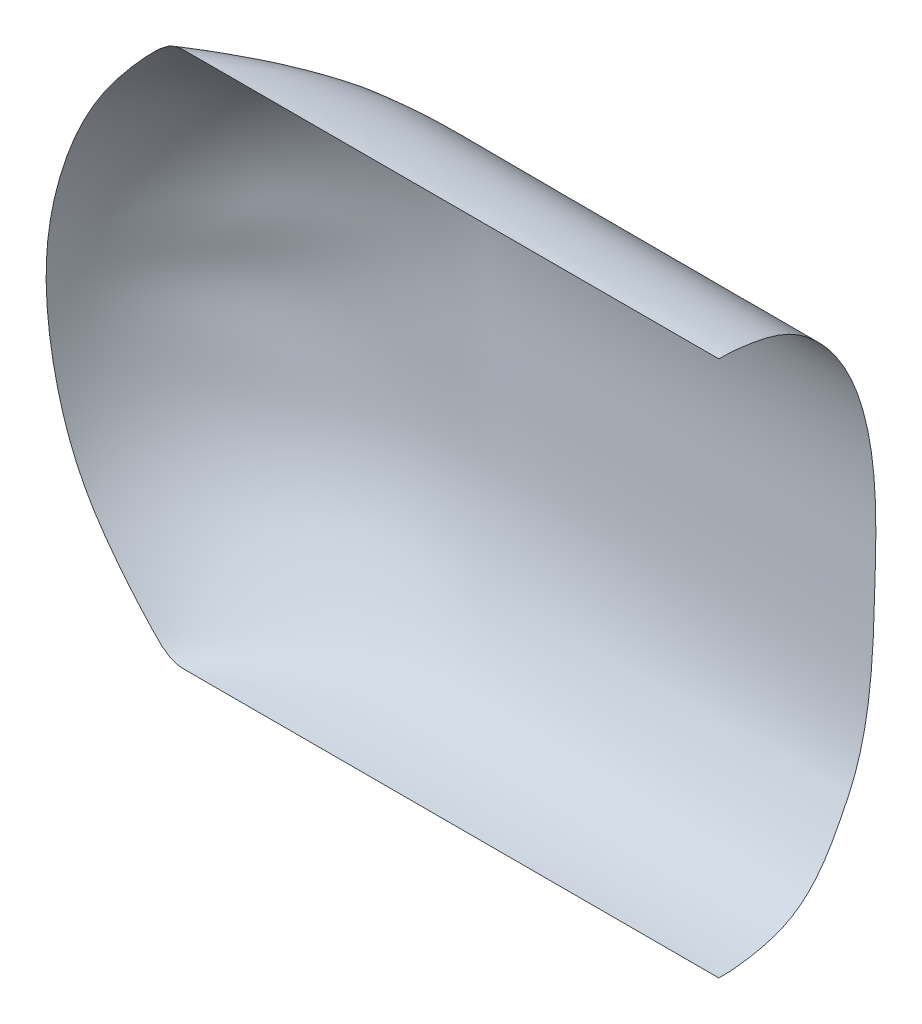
SolidWorks part; units mm, degrees
other "Detailelement1"
other "Detailelement2"
ref_plane "Vorne" through (0, 0, 0) normal (0, 0, 1) x (1, 0, 0)
ref_plane "Oben" through (0, 0, 0) normal (0, 1, 0) x (1, 0, 0)
ref_plane "Rechts" through (0, 0, 0) normal (1, 0, 0) x (0, 0, -1)
ref_plane "Ebene9" through (-2.6, 0, 0) normal (1, 0, 0) x (0, 0, -1)
sketch "Skizze1" plane through (0, 0, 0) normal (1, 0, 0) x (0, 0, -1)
  line L0 (3.2, 156.8) -> (0, 156.8) construction
  line L1 (0, 50) -> (0, -50) construction
  line L2 (3.2, 0.2) -> (0, 0.2) construction
  spline S0 degree 3 poles (3.2, 156.8) (15.2457, 155.9042) (27.1788, 150.7711) (41.6052, 131.374) (46.4817, 103.4678) (45.6711, 76.7617) (44.9684, 50.2216) (41.0626, 33.5474) (33.7229, 18.6011) (27.0223, 4.6845) (11.2445, 0.838) (3.2, 0.2) knots 0 0 0 0 0.105782 0.226264 0.395331 0.515131 0.648751 0.76968 0.76968 0.912711 1 1 1 1 construction
  spline S1 degree 3 poles (0, 156.8) (0.9827, 156.8) (1.9655, 156.8) (2.9482, 156.8) (3.0017, 156.8) (3.1086, 156.8) (3.2692, 156.7949) (3.3758, 156.7868) (3.4291, 156.7827) (3.4546, 156.7808) (3.5055, 156.7769) (3.5819, 156.7709) (3.6328, 156.7669) (3.6583, 156.7649) (15.388, 155.8427) (27.2281, 150.7048) (41.6052, 131.374) (46.4817, 103.4678) (45.6711, 76.7617) (44.9684, 50.2216) (41.0626, 33.5474) (33.7229, 18.6011) (27.0669, 4.7771) (11.4542, 0.8897) (3.6221, 0.2344) (3.5987, 0.2324) (3.5518, 0.2285) (3.4814, 0.2227) (3.4345, 0.2189) (3.411, 0.217) (3.3558, 0.2125) (3.2454, 0.2035) (3.0789, 0.2) (2.9681, 0.2) (2.9127, 0.2) (1.9418, 0.2) (0.9709, 0.2) (0, 0.2) knots 0 0 0 0 0.008542 0.008542 0.008542 0.009007 0.009472 0.009936 0.009936 0.009936 0.010158 0.01038 0.010602 0.010602 0.010602 0.112873 0.230863 0.396434 0.513757 0.644613 0.76304 0.76304 0.903113 0.987095 0.987095 0.987095 0.987347 0.987598 0.98785 0.98785 0.98785 0.988442 0.989033 0.989625 0.989625 0.989625 1 1 1 1
  dimension "D1" = 3.2
  dimension "D2" = 0.2
  dimension "D3" = 156.6
  dimension "D4" = 18.7
  dimension "D5" = 5
  dimension "D6" = 34.5
  dimension "D7" = 26.5
  dimension "D8" = 77
  dimension "D9" = 42.5
  dimension "D10" = 42.5
  dimension "D11" = 100.4
  dimension "D12" = 35.4
  dimension "D13" = 132.6
  dimension "D14" = 149.6
  dimension "D15" = 22.4
  dimension "D16" = 49.5
  dimension "D17" = 40.8
ref_plane "Ebene1" through (0, 5.2, 0) normal (0, 1, 0) x (-1, 0, 0)
ref_plane "Ebene2" through (0, 26.7, 0) normal (0, 1, 0) x (-1, 0, 0)
ref_plane "Ebene3" through (0, 49.7, 0) normal (0, 1, 0) x (-1, 0, 0)
ref_plane "Ebene4" through (0, 77.2, 0) normal (0, 1, 0) x (-1, 0, 0)
ref_plane "Ebene5" through (0, 100.6, 0) normal (0, 1, 0) x (-1, 0, 0)
ref_plane "Ebene6" through (0, 132.8, 0) normal (0, 1, 0) x (-1, 0, 0)
ref_plane "Ebene7" through (0, 149.8, 0) normal (0, 1, 0) x (-1, 0, 0)
ref_plane "Ebene8" through (0, 156.8, 0) normal (0, 1, 0) x (-1, 0, 0)
ref_plane "Ebene16" through (0, 156, 0) normal (0, 1, 0) x (-1, 0, 0)
sketch "Skizze49" plane through (0, 0, 0) normal (0, 0, 1) x (1, 0, 0)
  line L5 (-160.3768, -1.5) -> (-112.2, -1.5) construction
  line L12 (160.3768, 158.5) -> (-160.3768, 158.5)
  line L13 (-112.2, -1.5) -> (160.3768, -1.5)
  line L14 (-112.2, 97.5) -> (-112.2, -1.5)
  line L15 (-196.7324, 97.5) -> (-112.2, 97.5)
  arc A1 (-196.7324, 97.5) -> (-160.3768, -1.5) centre (-95.5, 78.5) ccw construction
  arc A4 (160.3768, -1.5) -> (160.3768, 158.5) centre (95.5, 78.5) ccw
  arc A5 (-160.3768, 158.5) -> (-196.7324, 97.5) centre (-95.5, 78.5) ccw
  point P0 (0, 158.5)
  point P1 (-198.5, 78.5)
  dimension "D1" = 103
  dimension "D2" = 95.5
  dimension "D3" = 160.3768
  dimension "D4" = 78.5
  dimension "D5" = 112.2
  dimension "D7" = 196.7324
sketch "Skizze2" plane through (0, 0, 0) normal (0, 0, 1) x (1, 0, 0)
  line L3 (0, 0) -> (0, 174.3868) construction
  line L9 (160.3768, 157) -> (-160.3768, 157)
  line L10 (0, 157) -> (-156.7291, 157) construction
  line L12 (-112.2, 0) -> (160.3768, 0)
  line L13 (-156.7291, 0) -> (0, 0) construction
  arc A2 (-156.7291, 157) -> (-162.3253, 154.8978) centre (-156.7291, 148.5) ccw
  arc A3 (-159.432, 157.335) -> (-195.2581, 97.2233) centre (-95.5, 78.5) ccw
  arc A4 (-162.3253, 154.8978) -> (-162.3253, 2.1022) centre (-95.5, 78.5) ccw
  arc A5 (-156.7291, 0) -> (-162.3253, 2.1022) centre (-156.7291, 8.5) cw
  dimension "D4" = 8.5
  dimension "D1" = 1.5
  dimension "D2" = 1.5
  dimension "D3" = 1.5
ref_plane "Ebene14" through (-131, 0, 0) normal (1, 0, 0) x (0, 0, -1)
sketch "Skizze55" plane through (0, 156, 0) normal (0, 1, 0) x (-1, 0, 0)
  line L0 (0, -14) -> (111.4939, -14)
  line L3 (156.7291, 0) -> (0, 0) construction
  line L4 (131, 31.1553) -> (131, -31.1553) construction
  spline S0 degree 3 poles (111.4939, -14) (115.4531, -14) (129.06, -13.3693) (148.1121, -12.3425) (157.9547, -2.7141) (160.7291, 0) knots 0 0 0 0 0.228126 0.782425 1 1 1 1
  point P7 (131, -13.1697)
  dimension "D1" = 14
sketch "Skizze50" plane through (-131, 0, 0) normal (1, 0, 0) x (0, 0, -1)
  line L0 (0, 0) -> (0, 174.3868) construction
  line L1 (0, 157) -> (0, 0) construction
  line L2 (0, 50) -> (0, -50) construction
  line L4 (50, 149.8) -> (-50, 149.8) construction
  line L5 (50, 132.8) -> (-50, 132.8) construction
  line L6 (50, 100.6) -> (-50, 100.6) construction
  line L7 (50, 77.2) -> (-50, 77.2) construction
  line L8 (50, 49.7) -> (-50, 49.7) construction
  line L9 (50, 26.7) -> (-50, 26.7) construction
  line L10 (50, 5.2) -> (-50, 5.2) construction
  spline S0 degree 3 poles (0, 157) (8.5122, 156.9557) (23.9183, 152.7103) (40.1662, 129.7413) (44.5725, 103.6919) (44.4936, 75.8497) (44.4405, 50.8612) (36.8503, 25.6232) (22.7946, 3.5725) (7.2538, 0.192) (0, 0) knots 0 0 0 0 0.122149 0.228137 0.392574 0.509781 0.647785 0.766119 0.899169 1 1 1 1
  dimension "D1" = 19.5
  dimension "D2" = 36
  dimension "D3" = 43
  dimension "D4" = 44.5
  dimension "D5" = 44
  dimension "D6" = 36.5
  dimension "D7" = 23.3
sketch "Skizze3" plane through (0, 77.2, 0) normal (0, 1, 0) x (-1, 0, 0)
  line L6 (0, -45.7) -> (109.9917, -45.7) construction
  line L7 (109.9917, -45.7) -> (0, -45.7)
  spline S0 degree 3 poles (196.9917, 0) (187.6717, -20.6245) (169.0841, -45.7) (109.9917, -45.7) knots 0 0 0 0 0.464629 0.464629 0.464629 0.464629
  dimension "D1" = 87
sketch "Skizze4" plane through (0, 100.6, 0) normal (0, 1, 0) x (-1, 0, 0)
  line L0 (109.9917, -45.7) -> (0, -45.7) construction
  line L2 (113.016, -45.7) -> (0, -45.7)
  spline S0 degree 3 poles (194.5648, 0) (191.7981, -9.8156) (178.628, -24.8693) (152.7983, -40.1344) (128.4869, -45.7) (113.016, -45.7) knots 0 0 0 0 0.262153 0.414728 1 1 1 1
sketch "Skizze5" plane through (0, 132.8, 0) normal (0, 1, 0) x (-1, 0, 0)
  line L0 (111.8072, -38.6) -> (0, -38.6)
  spline S0 degree 3 poles (181.2541, 0) (178.0784, -7.8324) (164.1456, -26.5451) (133.6778, -38.6) (111.8072, -38.6) knots 0 0 0 0 0.304709 1 1 1 1
sketch "Skizze6" plane through (0, 149.8, 0) normal (0, 1, 0) x (-1, 0, 0)
  line L0 (109.8377, -25.6) -> (0, -25.6)
  spline S0 degree 3 poles (109.8377, -25.6) (114.2791, -25.6) (116.8615, -25.5133) (121.4718, -24.951) (128.5974, -23.9761) (147.0768, -18.7761) (159.1973, -11.3151) (167.7396, 0) knots 0 0 0 0 0.158786 0.158786 0.268156 0.268156 1 1 1 1
sketch "Skizze7" plane through (0, 49.7, 0) normal (0, 1, 0) x (-1, 0, 0)
  line L5 (103.1492, -44) -> (0, -44)
  spline S0 degree 3 poles (103.1492, -44) (112.4168, -44.1404) (146.7141, -44.6599) (181.67, -25.7156) (192.8284, 0) knots 0 0 0 0 0.270212 1 1 1 1
sketch "Skizze8" plane through (0, 26.7, 0) normal (0, 1, 0) x (-1, 0, 0)
  line L5 (105.2431, -37.7) -> (0, -37.7)
  spline S0 degree 3 poles (105.2431, -37.7) (108.7754, -37.7501) (117.3735, -37.8721) (147.0552, -34.6806) (170.895, -21.3632) (182.7869, 0) knots 0 0 0 0 0.119435 0.290725 1 1 1 1
sketch "Skizze9" plane through (0, 5.2, 0) normal (0, 1, 0) x (-1, 0, 0)
  line L0 (107.7335, -21.9) -> (0, -21.9)
  spline S0 degree 3 poles (107.7335, -21.9) (135.1853, -21.9) (155.2232, -13.0451) (165.7094, 0) knots 0 0 0 0 1 1 1 1
sketch "Skizze14" plane through (0, 0, 0) normal (0, 0, 1) x (1, 0, 0)
  line L1 (0, 157) -> (-156.7291, 157) construction
  line L2 (0, 157) -> (-156.7291, 157)
  arc A1 (-156.7291, 157) -> (-162.3253, 154.8978) centre (-156.7291, 148.5) ccw construction
  arc A2 (-156.7291, 157) -> (-162.3253, 154.8978) centre (-156.7291, 148.5) ccw
sketch "Skizze15" plane through (0, 0, 0) normal (0, 0, 1) x (1, 0, 0)
  line L1 (-156.7291, 0) -> (0, 0) construction
  line L2 (-156.7291, 0) -> (0, 0)
  arc A1 (-162.3253, 2.1022) -> (-156.7291, 0) centre (-156.7291, 8.5) ccw construction
  arc A2 (-162.3253, 2.1022) -> (-156.7291, 0) centre (-156.7291, 8.5) ccw
surface "Oberfläche-Ausformung2" parameters "gD1"=0
